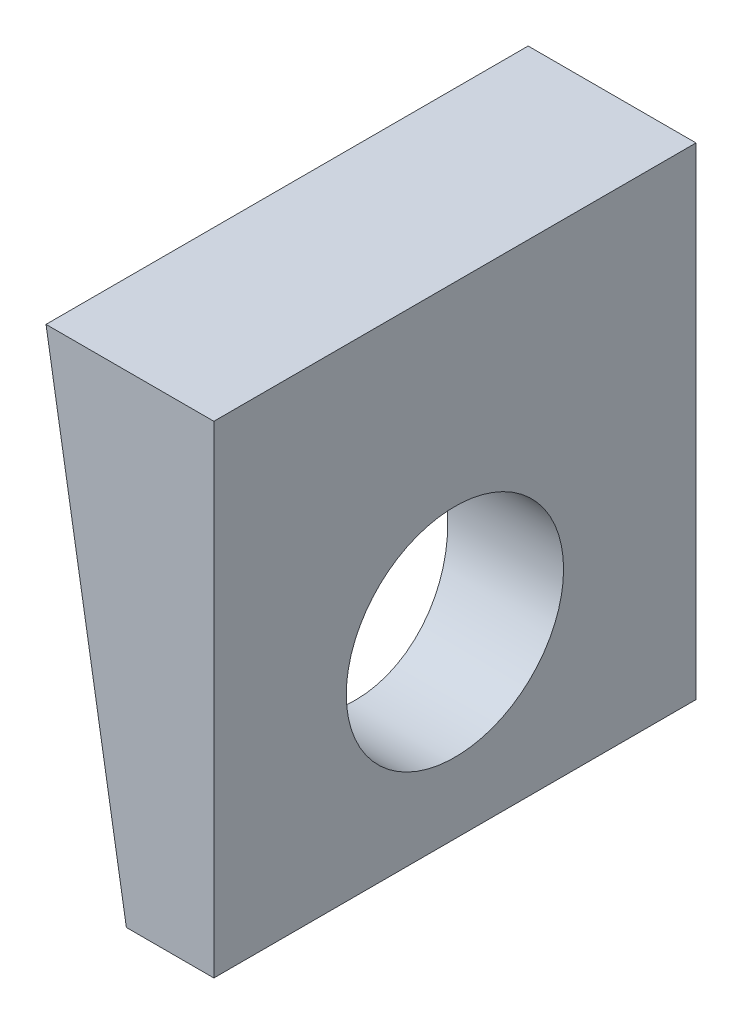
SolidWorks part; units mm, degrees
ref_plane "Plane1" through (0, 0, 0) normal (0, 0, 1) x (1, 0, 0)
ref_plane "Plane2" through (0, 0, 0) normal (0, 1, 0) x (1, 0, 0)
ref_plane "Plane3" through (0, 0, 0) normal (1, 0, 0) x (0, 0, -1)
sketch "Sketch1" plane through (0, 0, 0) normal (0, 0, 1) x (1, 0, 0)
  line L0 (0, 0) -> (-7.9248, 0) construction
  line L1 (-5.4309, -14.9631) -> (0, -14.9631)
  line L2 (0, 2.9058) -> (-8.4091, 2.9058) construction
  line L3 (0, -14.9631) -> (0, 14.9631)
  line L4 (0, 14.9631) -> (-10.4187, 14.9631)
  line L5 (-5.4309, -14.9631) -> (-10.4187, 14.9631)
  line L6 (0, -10.5816) -> (-6.1612, -10.5816) construction
  line L10 (-3.0806, -10.5816) -> (-3.0806, 2.9058) construction
  point P13 (0, 0)
  point P14 (-3.0806, -3.8379)
extrude "Boss-Extrude1" add sketch "Sketch1" along normal mid plane 29.9263
sketch "Sketch2" plane through (0, 0, 0) normal (1, 0, 0) x (0, 0, -1)
  line L0 (0, -10.5816) -> (0, 2.9058) construction
  circle A0 centre (0, -3.8379) radius 6.7437
  point P6 (0, -3.8379)
extrude "Cut-Extrude1" cut sketch "Sketch2" against normal through all
equation "\"D1@Boss-Extrude1\"=\"Outside_len@Sketch1\""
